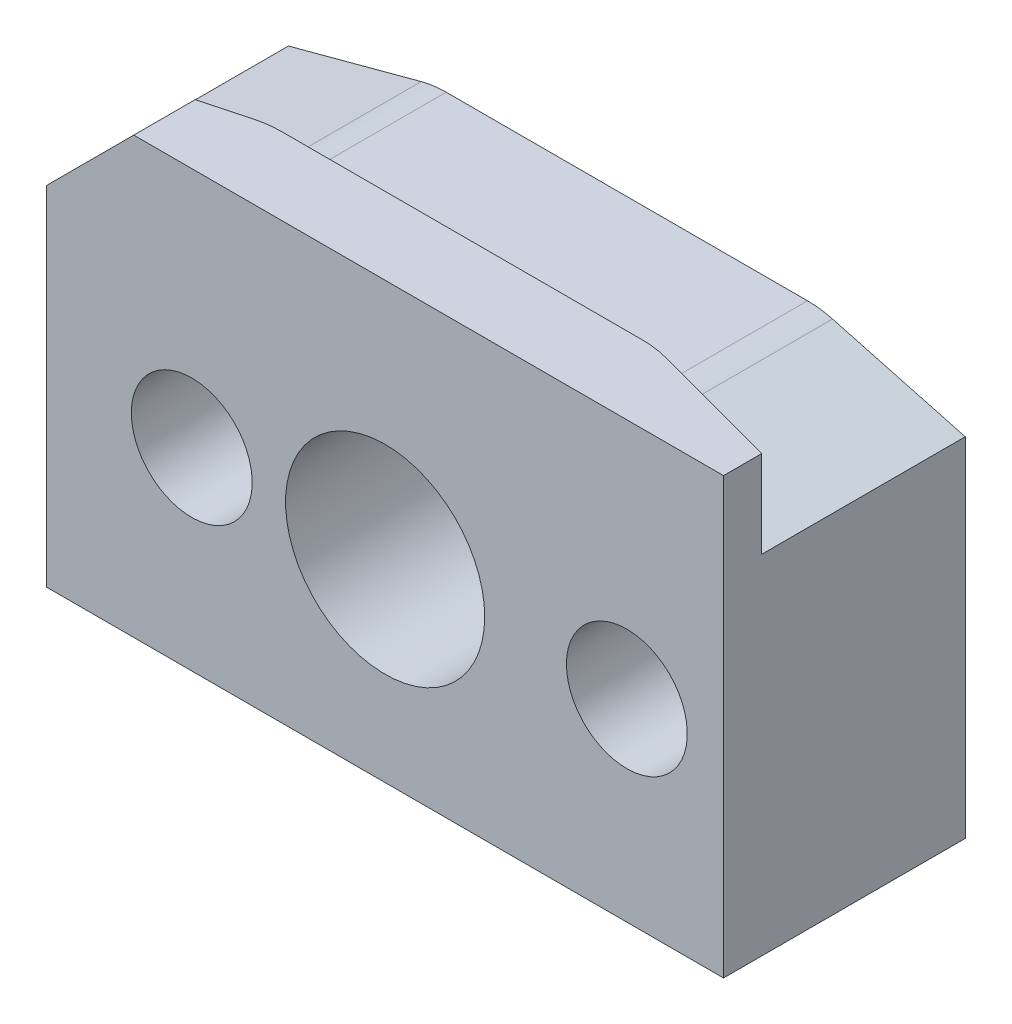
SolidWorks part; units mm, degrees
ref_plane "Front" through (0, 0, 0) normal (0, 0, 1) x (1, 0, 0)
ref_plane "Top" through (0, 0, 0) normal (0, 1, 0) x (1, 0, 0)
ref_plane "Right" through (0, 0, 0) normal (1, 0, 0) x (0, 0, -1)
sketch "Sketch1" plane through (0, 0, 0) normal (0, 0, 1) x (1, 0, 0)
  line L0 (-452.12, -180.975) -> (-452.12, 149.225) construction
  line L1 (-462.481, -76.9019) -> (-486.209, -76.9019)
  line L2 (-452.12, -79.4541) -> (-452.12, -102.3019)
  line L3 (-452.12, -102.3019) -> (-496.57, -102.3019)
  line L4 (-496.57, -79.4541) -> (-496.57, -102.3019)
  line L9 (-487.8525, -77.1182) -> (-496.57, -79.4541)
  line L10 (-452.12, -79.4541) -> (-460.8375, -77.1182)
  arc A0 (-487.8525, -77.1182) -> (-486.209, -76.9019) centre (-486.209, -83.2519) cw
  arc A1 (-460.8375, -77.1182) -> (-462.481, -76.9019) centre (-462.481, -83.2519) ccw
  arc A2 (-477.2812, -76.6445) -> (-475.3682, -76.0817) centre (-477.1377, -73.5999) ccw construction
  point P0 (-452.12, -76.9019)
  point P3 (-496.57, -76.9019)
  point P14 (-487.045, -76.9019)
  point P19 (-461.645, -76.9019)
  dimension "D9" = 6.35
  dimension "D1" = 0.254
  dimension "D3" = 25.4
  dimension "D4" = 44.45
  dimension "D5" = 9.525
  dimension "D6" = 15
  dimension "D7" = 9.525
  dimension "D8" = 15
extrude "Boss-Extrude1" add sketch "Sketch1" along normal blind 15.875 separate body
sketch "Sketch2" plane through (-452.12, 0, 0) normal (1, 0, 0) x (0, 0, -1)
  line L0 (-10.82, -81.661) -> (-10.82, -78.9217) construction
  line L1 (-10.82, -81.661) -> (-10.82, -58.827) construction
  line L3 (-15.875, -76.9019) -> (0, -76.9019) construction
  line L4 (-15.875, -102.3019) -> (-10.82, -102.3019)
  line L5 (-15.875, -102.3019) -> (-15.875, -73.7269)
  line L6 (-15.875, -73.7269) -> (-10.82, -73.7269)
  line L7 (-10.82, -102.3019) -> (-10.82, -73.7269)
  dimension "D1" = 3.175
  dimension "D2" = 28.575
extrude "Boss-Extrude2" add sketch "Sketch2" against normal up to surface (44.45 mm away)
chamfer "Chamfer1" distance 9.525 angle 15 2 edges at (-496.57, -76.5905, 10.82) (-452.12, -76.5905, 10.82)
fillet "Fillet1" radius 6.35 2 edges at (-461.645, -75.342, 10.82) (-487.045, -75.342, 10.82)
sketch "Sketch3" plane through (0, 0, 15.875) normal (0, 0, 1) x (1, 0, 0)
  line L0 (-496.57, -89.6019) -> (-452.12, -89.6019) construction
  line L1 (-474.345, -98.8779) -> (-474.345, -114.7529) construction
  line L2 (-467.995, -98.8779) -> (-467.995, -114.7529)
  line L3 (-480.695, -98.8779) -> (-480.695, -114.7529)
  line L4 (-452.12, -102.3019) -> (-452.12, -79.4541) construction
  line L5 (-496.57, -79.4541) -> (-496.57, -102.3019) construction
  line L6 (-496.57, -102.3019) -> (-452.12, -102.3019) construction
  arc A0 (-467.995, -98.8779) -> (-480.695, -98.8779) centre (-474.345, -98.8779) ccw
  arc A1 (-480.695, -114.7529) -> (-467.995, -114.7529) centre (-474.345, -114.7529) ccw
  point P2 (-493.395, -89.6019)
  point P3 (-487.045, -89.6019)
  point P4 (-458.47, -89.6019)
  point P5 (-455.295, -89.6019)
  point P6 (-474.345, -89.6019)
  point P9 (-474.345, -106.8154)
  point P14 (-467.995, -89.6019)
  point P15 (-477.52, -89.6019)
  dimension "D1" = 12.7
  dimension "D4" = 3.175
  dimension "D5" = 6.35
  dimension "D2" = 12.7
hole_wizard "Hole1" positions "Point_Sketch" profile "Profil_Sketch" counterbore size "1/4" standard "ANSI Inch"
sketch "Point_Sketch" plane through (-531.6641, -88.5171, 15.875) normal (0, 0, -1) x (1, 0, 0)
  point P0 (57.3191, 1.0848)
sketch "Profil_Sketch" plane through (-474.345, -89.6019, 15.875) normal (1, 0, 0) x (0, -1, 0)
  line L0 (0, 0) -> (0, 15.875)
  line L1 (0, 15.875) -> (4.3688, 15.875)
  line L3 (4.3688, 15.875) -> (4.3688, 9.652)
  line L4 (4.3688, 9.652) -> (6.5405, 9.652)
  line L5 (6.5405, 9.652) -> (6.5405, 0)
  line L7 (6.5405, 0) -> (0, 0)
  line L11 (0, -6.35) -> (0, 107.95) construction
  dimension "Diameter" = 8.7376
  dimension "Thru Hole Depth" = 15.875
  dimension "L1" = 9.652
other "usin_LS160_.3125-18x.75-SHCS<1>"
hole_wizard "Hole11" positions "Point_Sketch1" profile "Profil_Sketch1" hole size "Ø0.15" standard "ISO"
sketch "Point_Sketch1" plane through (-499.2657, -78.8509, 0) normal (0, 0, 1) x (-1, 0, 0)
  point P0 (-12.2207, 10.7509)
  point P2 (-40.7957, 10.7509)
sketch "Profil_Sketch1" plane through (-487.045, -89.6019, 0) normal (1, 0, 0) x (0, 1, 0)
  line L0 (0, 0) -> (0, 15.875)
  line L1 (0, 15.875) -> (3.9687, 15.875)
  line L2 (3.9687, 15.875) -> (3.9687, 0)
  line L5 (3.9687, 0) -> (0, 0)
  line L11 (0, -6.35) -> (0, 107.95) construction
  dimension "Diameter" = 7.9375
  dimension "Thru Hole Depth" = 15.875
other "usin_DL090_.3125 x 1.25 DOWEL PIN<1>"
chamfer "Chamfer2" distance 5.715 angle 45 1 edges at (-496.57, -73.7269, 14.6236)
